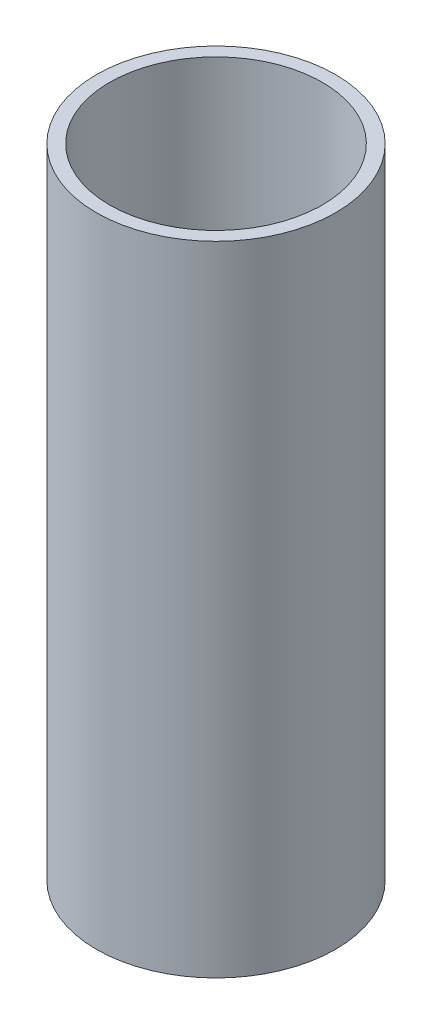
SolidWorks part; units mm, degrees
ref_plane "Front Plane" through (0, 0, 0) normal (0, 0, 1) x (1, 0, 0)
ref_plane "Top Plane" through (0, 0, 0) normal (0, 1, 0) x (1, 0, 0)
ref_plane "Right Plane" through (0, 0, 0) normal (1, 0, 0) x (0, 0, -1)
sketch "Sketch1" plane through (0, 0, 0) normal (0, 1, 0) x (1, 0, 0)
  circle A0 centre (0, 0) radius 90
  dimension "D1" = 180
extrude "Full Casing" add sketch "Sketch1" along normal blind 480
sketch "Sketch2" plane through (0, 0, 0) normal (0, -1, 0) x (1, 0, 0)
  circle A0 centre (0, 0) radius 80
  dimension "D1" = 160
extrude "Electronics Space" cut sketch "Sketch2" against normal blind 235
sketch "Sketch3" plane through (0, 480, 0) normal (0, 1, 0) x (1, 0, 0)
  circle A0 centre (0, 0) radius 80
  dimension "D1" = 160
extrude "Bladder Space" cut sketch "Sketch3" against normal blind 235 contours A0
